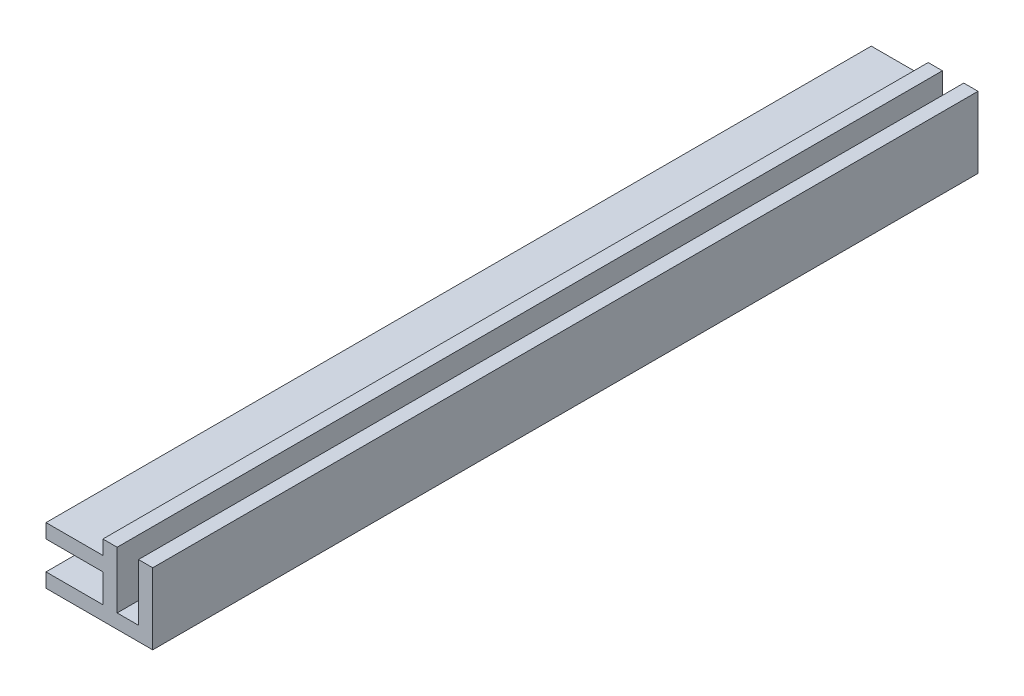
SolidWorks part; units mm, degrees
ref_plane "Plan de face" through (0, 0, 0) normal (0, 0, 1) x (1, 0, 0)
ref_plane "Plan de dessus" through (0, 0, 0) normal (0, 1, 0) x (1, 0, 0)
ref_plane "Plan de droite" through (0, 0, 0) normal (1, 0, 0) x (0, 0, -1)
sketch "Esquisse1" plane through (0, 0, 0) normal (0, 0, 1) x (1, 0, 0)
  line L1 (0, 0) -> (15, 0)
  line L2 (0, 0) -> (0, 10)
  line L3 (0, 10) -> (15, 10)
  line L4 (15, 0) -> (15, 10)
  dimension "D1" = 15
  dimension "D2" = 10
extrude "Extrusion1" add sketch "Esquisse1" along normal blind 116
sketch "Esquisse2" plane through (0, 0, 116) normal (0, 0, 1) x (1, 0, 0)
  line L0 (0, 10) -> (0, 0) construction
  line L1 (0, 6) -> (8, 6)
  line L2 (0, 6) -> (0, 2)
  line L3 (0, 2) -> (8, 2)
  line L4 (8, 6) -> (8, 2)
  line L5 (0, 0) -> (15, 0) construction
  dimension "D1" = 2
  dimension "D2" = 8
extrude "Enlèv. mat.-Extru.1" cut sketch "Esquisse2" against normal through all
sketch "Esquisse3" plane through (0, 0, 116) normal (0, 0, 1) x (1, 0, 0)
  line L0 (8, 6) -> (0, 6) construction
  line L1 (0, 10) -> (8, 10)
  line L2 (0, 10) -> (0, 8)
  line L3 (0, 8) -> (8, 8)
  line L4 (8, 10) -> (8, 8)
  dimension "D1" = 2
extrude "Enlèv. mat.-Extru.2" cut sketch "Esquisse3" against normal through all
sketch "Esquisse4" plane through (0, 0, 116) normal (0, 0, 1) x (1, 0, 0)
  line L0 (15, 10) -> (8, 10) construction
  line L1 (10, 10) -> (13, 10)
  line L2 (10, 10) -> (10, 2)
  line L3 (10, 2) -> (13, 2)
  line L4 (13, 10) -> (13, 2)
extrude "Enlèv. mat.-Extru.3" cut sketch "Esquisse4" against normal through all
